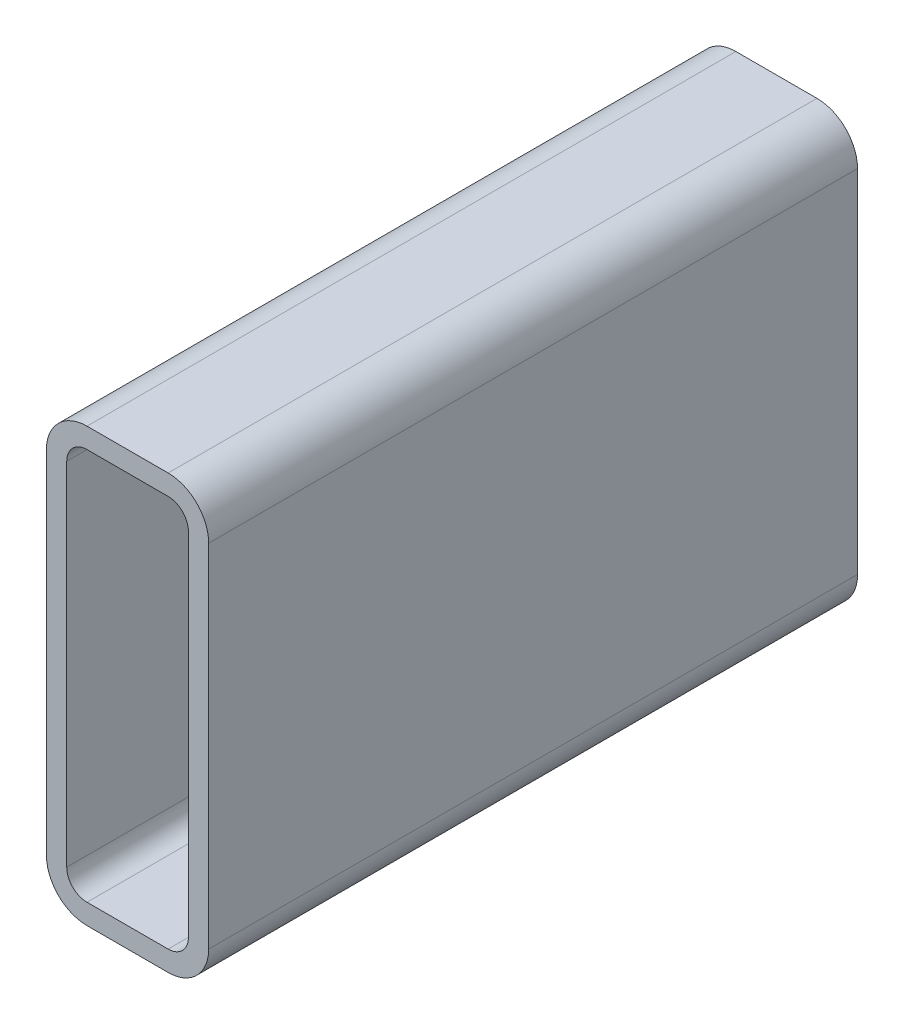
SolidWorks part; units mm, degrees
ref_plane "Front Plane" through (0, 0, 0) normal (0, 0, 1) x (1, 0, 0)
ref_plane "Top Plane" through (0, 0, 0) normal (0, 1, 0) x (1, 0, 0)
ref_plane "Right Plane" through (0, 0, 0) normal (1, 0, 0) x (0, 0, -1)
sketch "Sketch1" plane through (0, 0, 0) normal (0, 0, 1) x (1, 0, 0)
sketch_block_instance "HSS8x3x0.375-1"
sketch_block "HSS8x3x0.375"
extrude "Boss-Extrude1" add sketch "Sketch1" along normal blind 304.8
